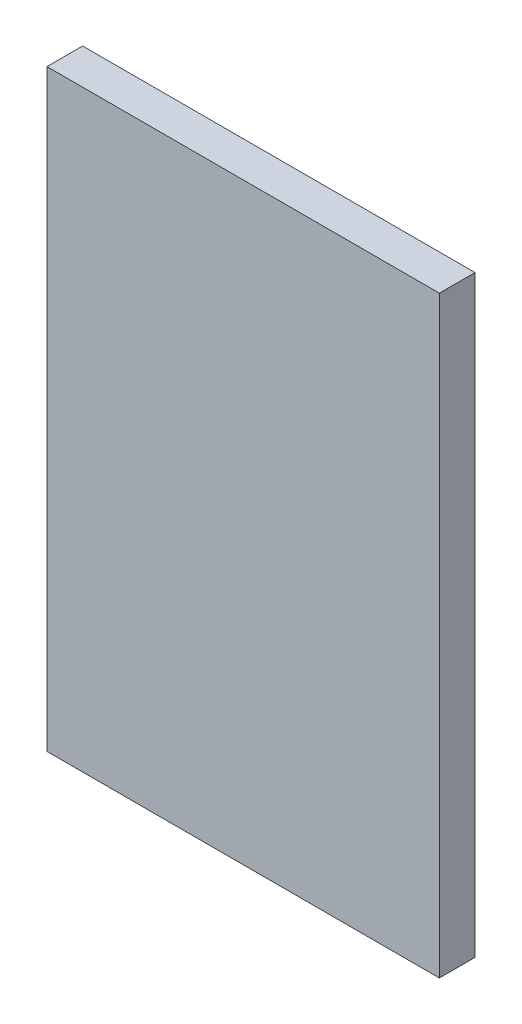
SolidWorks part; units mm, degrees
ref_plane "Спереди" through (0, 0, 0) normal (0, 0, 1) x (1, 0, 0)
ref_plane "Сверху" through (0, 0, 0) normal (0, 1, 0) x (1, 0, 0)
ref_plane "Справа" through (0, 0, 0) normal (1, 0, 0) x (0, 0, -1)
sketch "Эскиз1" plane through (0, 0, 0) normal (0, 0, 1) x (1, 0, 0)
  line L1 (-88, 133) -> (88, 133)
  line L2 (-88, 133) -> (-88, -133)
  line L3 (-88, -133) -> (88, -133)
  line L4 (88, 133) -> (88, -133)
  line L5 (-88, 133) -> (88, -133) construction
  line L6 (-88, -133) -> (88, 133) construction
  point P0 (0, 0)
extrude "Бобышка-Вытянуть1" add sketch "Эскиз1" along normal blind 16
